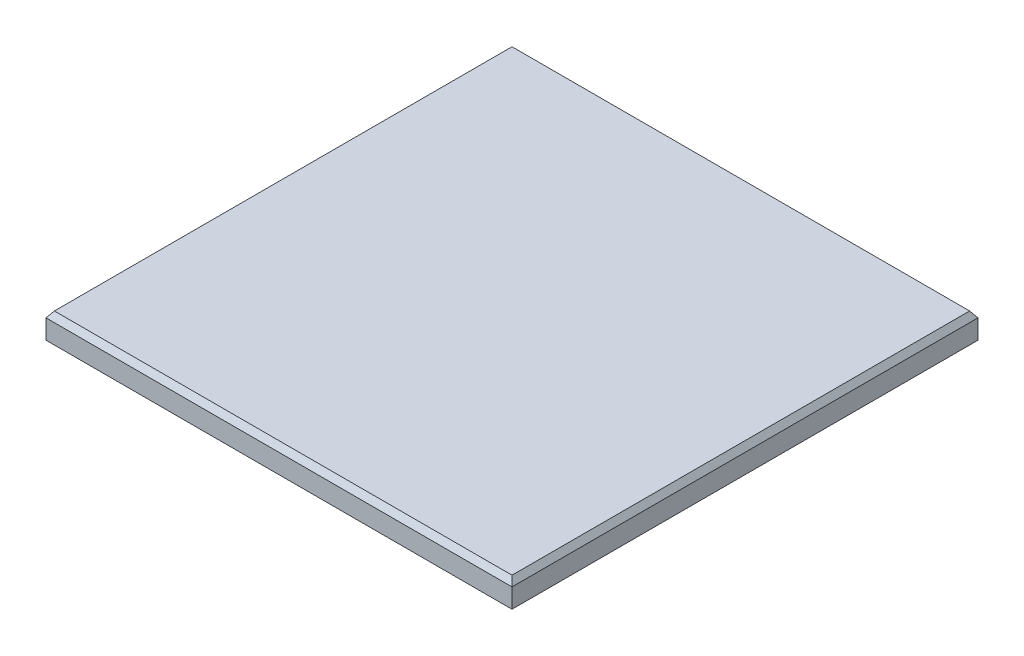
SolidWorks part; units mm, degrees
ref_plane "Front Plane" through (0, 0, 0) normal (0, 0, 1) x (1, 0, 0)
ref_plane "Top Plane" through (0, 0, 0) normal (0, 1, 0) x (1, 0, 0)
ref_plane "Right Plane" through (0, 0, 0) normal (1, 0, 0) x (0, 0, -1)
imported_body "Imported1"
other "Move Face1"
sketch "Sketch1" plane through (0, 0.5, 0) normal (0, 1, 0) x (1, 0, 0)
  line L1 (-9.75, 10) -> (9.75, 10)
  line L2 (-9.75, 10) -> (-9.75, -9.5)
  line L3 (-9.75, -9.5) -> (9.75, -9.5)
  line L4 (9.75, 10) -> (9.75, -9.5)
extrude "Extrude1" cut sketch "Sketch1" against normal through all flip side to cut
